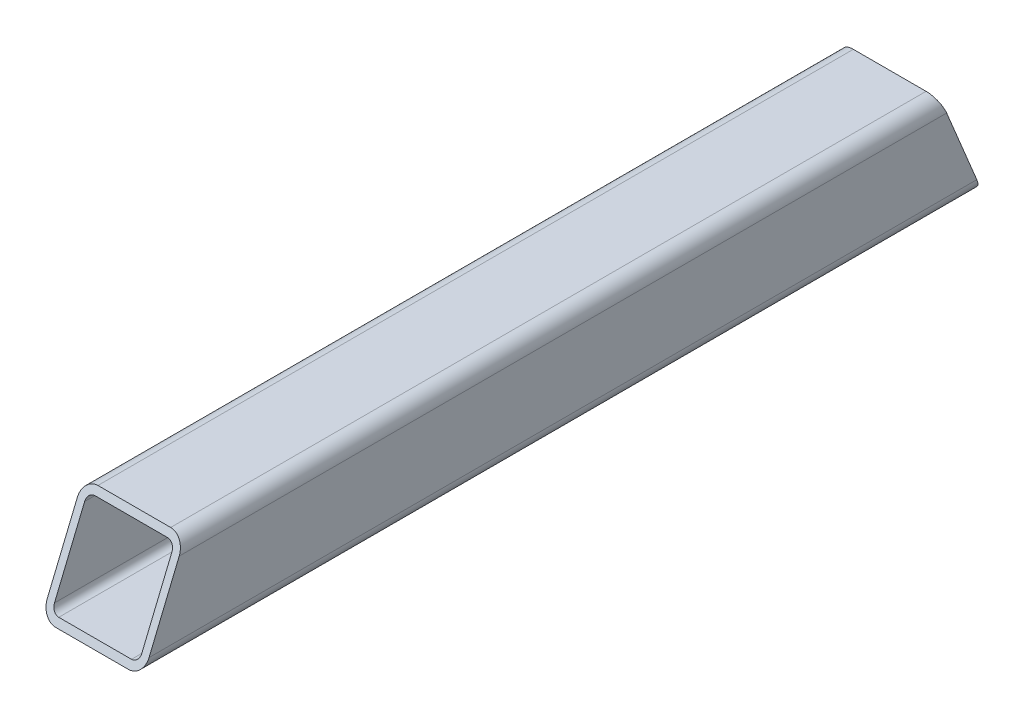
SolidWorks part; units mm, degrees
ref_plane "Plan de face" through (0, 0, 0) normal (0, 0, 1) x (1, 0, 0)
ref_plane "Plan de dessus" through (0, 0, 0) normal (0, 1, 0) x (1, 0, 0)
ref_plane "Plan de droite" through (0, 0, 0) normal (1, 0, 0) x (0, 0, -1)
sketch "Esquisse1" plane through (0, 0, 0) normal (0, 0, 1) x (1, 0, 0)
  line L0 (-25, 30) -> (25, 30)
  line L1 (-25, 35) -> (25, 35)
  line L2 (-35, 25) -> (-35, -25)
  line L3 (-25, -35) -> (25, -35)
  line L4 (35, 25) -> (35, -25)
  line L5 (30, 25) -> (30, -25)
  line L6 (-25, -30) -> (25, -30)
  line L7 (-30, 25) -> (-30, -25)
  arc A0 (-25, -35) -> (-35, -25) centre (-25, -25) cw
  arc A1 (35, 25) -> (25, 35) centre (25, 25) ccw
  arc A2 (-25, 35) -> (-35, 25) centre (-25, 25) ccw
  arc A3 (35, -25) -> (25, -35) centre (25, -25) cw
  arc A4 (30, 25) -> (25, 30) centre (25, 25) ccw
  arc A5 (30, -25) -> (25, -30) centre (25, -25) cw
  arc A6 (-25, -30) -> (-30, -25) centre (-25, -25) cw
  arc A7 (-25, 30) -> (-30, 25) centre (-25, 25) ccw
  point P4 (35, 0)
  point P6 (0, 35)
  point P11 (35, 35)
  point P14 (-35, 35)
  point P17 (35, -35)
  dimension "D3" = 10
  dimension "D4" = 10
  dimension "D1" = 70
  dimension "D2" = 70
  dimension "D5" = 5
extrude "Boss.-Extru.1" add sketch "Esquisse1" along normal mid plane 594
sketch "Esquisse2" plane through (35, 0, 0) normal (1, 0, 0) x (0, 0, -1)
  line L0 (208.5233, 158.1995) -> (297, -55.402)
  line L1 (297, -25) -> (297, 25) construction
  line L2 (297, -55.402) -> (297, 127.4131)
  dimension "D1" = 22.5
  dimension "D2" = 20.402
extrude "Enlèv. mat.-Extru.1" cut sketch "Esquisse2" against normal through all and the other way through all
mirror "Symétrie1" about plane through (0, 0, 0) normal (0, 0, 1) of "Enlèv. mat.-Extru.1"
